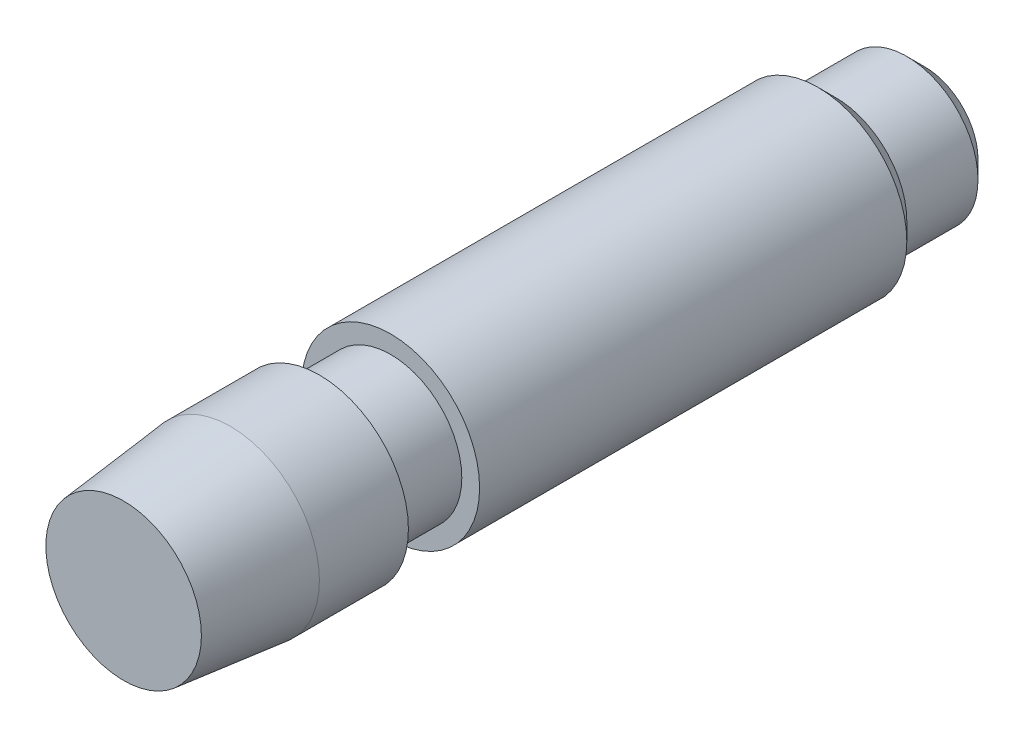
SolidWorks part; units mm, degrees
ref_plane "Face" through (0, 0, 0) normal (0, 0, 1) x (1, 0, 0)
ref_plane "Dessus" through (0, 0, 0) normal (0, 1, 0) x (1, 0, 0)
ref_plane "Droite" through (0, 0, 0) normal (1, 0, 0) x (0, 0, -1)
sketch "Esquisse1" plane through (0, 0, 0) normal (0, 0, 1) x (1, 0, 0)
  circle A0 centre (0, 0) radius 4
  dimension "D1" = 8
extrude "Base-Extrusion" add sketch "Esquisse1" along normal blind 5
sketch "Esquisse2" plane through (0, 0, 5) normal (0, 0, 1) x (1, 0, 0)
  circle A0 centre (0, 0) radius 5
  circle A1 centre (0, 0) radius 4 construction
  dimension "D1" = 10
extrude "Boss.-Extru.1" add sketch "Esquisse2" along normal blind 25
chamfer "Chanfrein1" distance 1 angle 45
chamfer "Chanfrein2" distance 1 angle 45
sketch "Esquisse3" plane through (0, 0, 30) normal (0, 0, 1) x (1, 0, 0)
  circle A0 centre (0, 0) radius 4
  circle A1 centre (0, 0) radius 5 construction
  dimension "D1" = 8
extrude "Boss.-Extru.2" add sketch "Esquisse3" along normal blind 4
sketch "Esquisse4" plane through (0, 0, 34) normal (0, 0, 1) x (1, 0, 0)
  circle A0 centre (0, 0) radius 5
  circle A1 centre (0, 0) radius 4 construction
  dimension "D1" = 10
extrude "Boss.-Extru.3" add sketch "Esquisse4" along normal blind 5
sketch "Esquisse5" plane through (0, 0, 39) normal (0, 0, 1) x (1, 0, 0)
  circle A1 centre (0, 0) radius 5
  circle A2 centre (0, 0) radius 5
  dimension "D1" = 0
extrude "Boss.-Extru.4" add sketch "Esquisse5" along normal blind 6 draft 6
